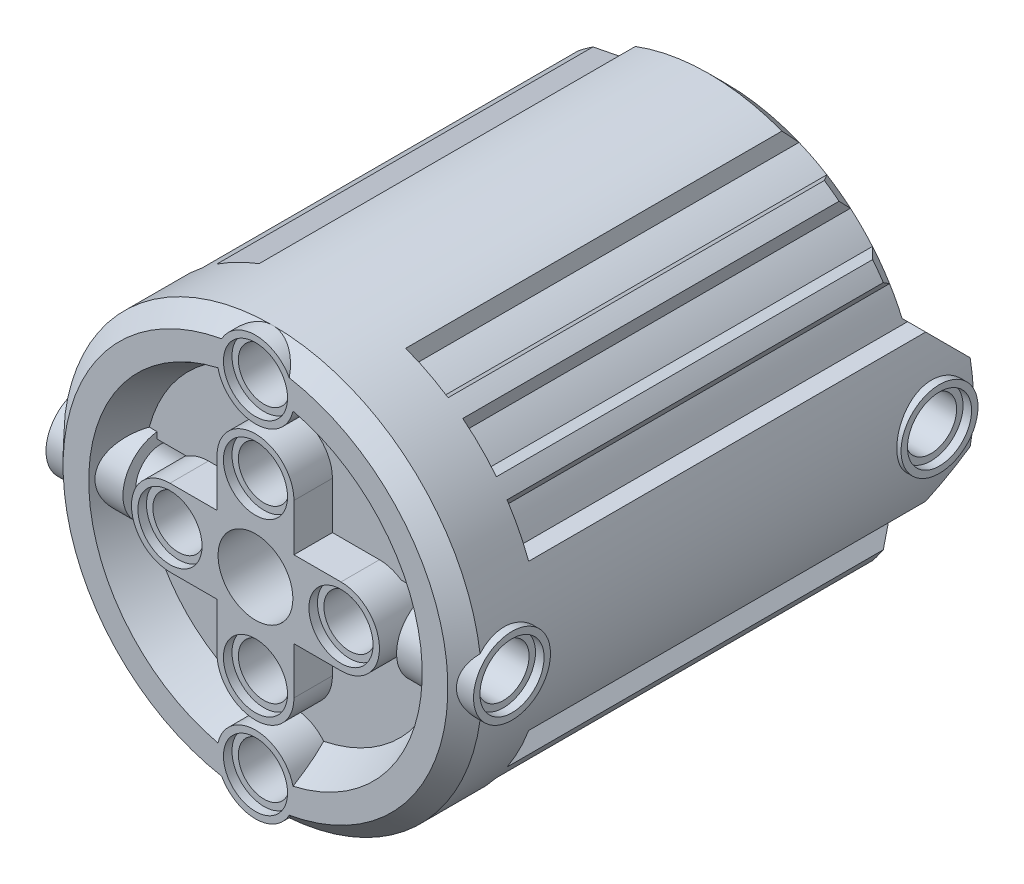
SolidWorks part; units mm, degrees
ref_plane "Front Plane" through (0, 0, 0) normal (0, 0, 1) x (1, 0, 0)
ref_plane "Top Plane" through (0, 0, 0) normal (0, 1, 0) x (1, 0, 0)
ref_plane "Right Plane" through (0, 0, 0) normal (1, 0, 0) x (0, 0, -1)
sketch "Sketch1" plane through (0, 0, 0) normal (0, 0, 1) x (1, 0, 0)
  circle A9 centre (0, 0) radius 19.6
extrude "Boss-Extrude1" add sketch "Sketch1" against normal blind 47.6
chamfer "Chamfer1" distance 1.6 angle 45 1 edges at (19.6, 0, 0)
sketch "Sketch2" plane through (0, 0, 0) normal (0, 0, 1) x (1, 0, 0)
  line L0 (-3.6, 8) -> (-3.6, 3.6)
  line L1 (3.6, 8) -> (3.6, 3.6)
  line L2 (8, 3.6) -> (3.6, 3.6)
  line L3 (-8, -3.6) -> (-3.6, -3.6)
  line L4 (-3.6, -3.6) -> (-3.6, -8)
  line L5 (-3.6, 3.6) -> (-8, 3.6)
  line L6 (3.6, -3.6) -> (3.6, -8)
  line L7 (3.6, -3.6) -> (8, -3.6)
  arc A0 (2.786, -13.72) -> (2.786, 13.72) centre (0, 0) ccw
  circle A1 centre (0, 0) radius 19.6 construction
  arc A2 (3.6, 8) -> (-3.6, 8) centre (0, 8) ccw
  arc A3 (-3.6, -8) -> (3.6, -8) centre (0, -8) ccw
  arc A4 (8, -3.6) -> (8, 3.6) centre (8, 0) ccw
  arc A5 (-8, 3.6) -> (-8, -3.6) centre (-8, 0) ccw
  arc A6 (-2.786, 13.72) -> (2.786, 13.72) centre (0, 16) ccw
  arc A7 (2.786, -13.72) -> (-2.786, -13.72) centre (0, -16) ccw
  arc A9 (-2.786, 13.72) -> (-2.786, -13.72) centre (0, 0) ccw
  dimension "D1" = 5.6
  dimension "D2" = 8
  dimension "D3" = 8
  dimension "D4" = 8
  dimension "D5" = 8
  dimension "D6" = 16
  dimension "D7" = 0
  dimension "D8" = 16
extrude "Cut-Extrude1" cut sketch "Sketch2" against normal blind 3.6
chamfer "Chamfer3" distance 1.6 distance2 3.6 1 edges at (-14, 0, 0)
chamfer "Chamfer4" distance 1.6 distance2 3.6 1 edges at (14, 0, 0)
sketch "Sketch4" plane through (0, 0, 0) normal (0, 0, 1) x (1, 0, 0)
  circle A0 centre (0, 16) radius 3.6
  circle A1 centre (0, -16) radius 3.6
extrude "Boss-Extrude2" add sketch "Sketch4" against normal blind 3.6
sketch "Sketch3" plane through (0, 0, 0) normal (0, 0, 1) x (1, 0, 0)
  circle A0 centre (0, 8) radius 2.4
  circle A1 centre (0, 0) radius 3.5
  circle A2 centre (8, 0) radius 2.4
  circle A3 centre (-8, 0) radius 2.4
  circle A4 centre (0, -8) radius 2.4
  circle A6 centre (0, 16) radius 2.4
  circle A7 centre (0, -16) radius 2.4
  dimension "D1" = 7
  dimension "D2" = 4.8
  dimension "D3" = 4.8
  dimension "D4" = 4.8
  dimension "D5" = 4.8
  dimension "D6" = 8
  dimension "D7" = 8
  dimension "D8" = 8
  dimension "D9" = 8
extrude "Cut-Extrude2" cut sketch "Sketch3" against normal blind 8
ref_plane "Plane1" through (20, 0, 0) normal (1, 0, 0) x (0, 0, -1)
sketch "Sketch5" plane through (20, 0, 0) normal (1, 0, 0) x (0, 0, -1)
  line L0 (0, 17.72) -> (0, -17.72) construction
  circle A1 centre (4, 0) radius 3.6
  circle A2 centre (44, 0) radius 3.6
  dimension "D1" = 4
  dimension "D2" = 40
extrude "Boss-Extrude3" add sketch "Sketch5" against normal blind 7.2
mirror "Mirror1" about plane through (0, 0, 0) normal (1, 0, 0) of "Boss-Extrude3"
sketch "Sketch6" plane through (0, 0, 0) normal (0, 0, 1) x (1, 0, 0)
  circle A0 centre (0, 8) radius 3
  circle A1 centre (8, 0) radius 3
  circle A2 centre (-8, 0) radius 3
  circle A3 centre (0, -8) radius 3
  circle A4 centre (0, -16) radius 3
  circle A5 centre (0, 16) radius 3
extrude "Cut-Extrude3" cut sketch "Sketch6" against normal blind 0.8
sketch "Sketch7" plane through (20, 0, 0) normal (1, 0, 0) x (0, 0, -1)
  circle A0 centre (4, 0) radius 2.4
  circle A1 centre (44, 0) radius 2.4
extrude "Cut-Extrude4" cut sketch "Sketch7" against normal up to surface (8.4 mm away)
sketch "Sketch8" plane through (20, 0, 0) normal (1, 0, 0) x (0, 0, -1)
  circle A0 centre (4, 0) radius 3
  circle A1 centre (44, 0) radius 3
extrude "Cut-Extrude5" cut sketch "Sketch8" against normal blind 0.8
sketch "Sketch9" plane through (20, 0, 0) normal (1, 0, 0) x (0, 0, -1)
  line L0 (44, 20.4632) -> (44, 7.2)
  line L1 (47.6, 0) -> (47.6, 19.6) construction
  line L2 (47.6, 20.4632) -> (47.6, 3.6)
  line L3 (47.6, 3.6) -> (44, 7.2)
  line L4 (44, 20.4632) -> (47.6, 20.4632)
  line L5 (4, 0) -> (44, 0) construction
  line L6 (44, -20.4632) -> (47.6, -20.4632)
  line L7 (47.6, -3.6) -> (44, -7.2)
  line L8 (47.6, -20.4632) -> (47.6, -3.6)
  line L9 (44, -20.4632) -> (44, -7.2)
  dimension "D1" = 3.6
  dimension "D2" = 3.6
extrude "Cut-Extrude6" cut sketch "Sketch9" against normal through all
ref_plane "Plane2" through (0, 0, -7.2) normal (0, 0, 1) x (1, 0, 0)
sketch "Sketch10" plane through (0, 0, -7.2) normal (0, 0, 1) x (1, 0, 0)
  line L3 (15.344, 12.1952) -> (13.7095, 11.6641)
  line L20 (6.8567, 18.3615) -> (6.8567, 16.6429)
  line L22 (10.8245, 16.3398) -> (9.4341, 15.3296)
  line L23 (12.1952, 15.344) -> (11.6641, 13.7095)
  line L24 (18.3615, 6.8567) -> (16.6429, 6.8567)
  line L26 (16.3398, 10.8245) -> (15.3296, 9.4341)
  line L31 (16.3398, -10.8245) -> (15.3296, -9.4341)
  line L32 (18.3615, -6.8567) -> (16.6429, -6.8567)
  line L33 (12.1952, -15.344) -> (11.6641, -13.7095)
  line L34 (15.344, -12.1952) -> (13.7095, -11.6641)
  line L35 (6.8567, -18.3615) -> (6.8567, -16.6429)
  line L36 (10.8245, -16.3398) -> (9.4341, -15.3296)
  line L41 (-10.8245, -16.3398) -> (-9.4341, -15.3296)
  line L42 (-6.8567, -18.3615) -> (-6.8567, -16.6429)
  line L43 (-15.344, -12.1952) -> (-13.7095, -11.6641)
  line L44 (-12.1952, -15.344) -> (-11.6641, -13.7095)
  line L45 (-18.3615, -6.8567) -> (-16.6429, -6.8567)
  line L46 (-16.3398, -10.8245) -> (-15.3296, -9.4341)
  line L51 (-16.3398, 10.8245) -> (-15.3296, 9.4341)
  line L52 (-18.3615, 6.8567) -> (-16.6429, 6.8567)
  line L53 (-12.1952, 15.344) -> (-11.6641, 13.7095)
  line L54 (-15.344, 12.1952) -> (-13.7095, 11.6641)
  line L55 (-6.8567, 18.3615) -> (-6.8567, 16.6429)
  line L56 (-10.8245, 16.3398) -> (-9.4341, 15.3296)
  line L61 (-0.8471, 19.5817) -> (-1.3782, 17.9472)
  line L62 (-5.2454, 18.8851) -> (-4.2352, 17.4947)
  line L63 (5.2454, 18.8851) -> (4.2352, 17.4947)
  line L64 (0.8471, 19.5817) -> (1.3782, 17.9472)
  line L65 (-19.5817, -0.8471) -> (-17.9472, -1.3782)
  line L66 (-19.5817, 0.8471) -> (-17.9472, 1.3782)
  line L67 (-18.8851, 5.2454) -> (-17.4947, 4.2352)
  line L68 (-18.8851, -5.2454) -> (-17.4947, -4.2352)
  line L69 (0.8471, -19.5817) -> (1.3782, -17.9472)
  line L70 (5.2454, -18.8851) -> (4.2352, -17.4947)
  line L71 (-5.2454, -18.8851) -> (-4.2352, -17.4947)
  line L72 (-0.8471, -19.5817) -> (-1.3782, -17.9472)
  line L73 (19.5817, 0.8471) -> (17.9472, 1.3782)
  line L74 (18.8851, 5.2454) -> (17.4947, 4.2352)
  line L75 (18.8851, -5.2454) -> (17.4947, -4.2352)
  line L76 (19.5817, -0.8471) -> (17.9472, -1.3782)
  arc A4 (6.8567, 16.6429) -> (9.4552, 15.3166) centre (0, 0) cw
  arc A5 (6.8567, 18.3615) -> (10.8334, 16.334) centre (0, 0) cw
  arc A6 (12.1952, 15.344) -> (15.3506, 12.1868) centre (0, 0) cw
  arc A7 (11.6641, 13.7095) -> (13.7255, 11.6452) centre (0, 0) cw
  arc A8 (16.3398, 10.8245) -> (18.3652, 6.8467) centre (0, 0) cw
  arc A9 (15.3296, 9.4341) -> (16.6523, 6.8338) centre (0, 0) cw
  arc A14 (18.3615, -6.8567) -> (16.334, -10.8334) centre (0, 0) cw
  arc A15 (16.6429, -6.8567) -> (15.3166, -9.4552) centre (0, 0) cw
  arc A16 (15.344, -12.1952) -> (12.1868, -15.3506) centre (0, 0) cw
  arc A17 (13.7095, -11.6641) -> (11.6452, -13.7255) centre (0, 0) cw
  arc A18 (10.8245, -16.3398) -> (6.8467, -18.3652) centre (0, 0) cw
  arc A19 (9.4341, -15.3296) -> (6.8338, -16.6523) centre (0, 0) cw
  arc A24 (-6.8567, -18.3615) -> (-10.8334, -16.334) centre (0, 0) cw
  arc A25 (-6.8567, -16.6429) -> (-9.4552, -15.3166) centre (0, 0) cw
  arc A26 (-12.1952, -15.344) -> (-15.3506, -12.1868) centre (0, 0) cw
  arc A27 (-11.6641, -13.7095) -> (-13.7255, -11.6452) centre (0, 0) cw
  arc A28 (-16.3398, -10.8245) -> (-18.3652, -6.8467) centre (0, 0) cw
  arc A29 (-15.3296, -9.4341) -> (-16.6523, -6.8338) centre (0, 0) cw
  arc A34 (-18.3615, 6.8567) -> (-16.334, 10.8334) centre (0, 0) cw
  arc A35 (-16.6429, 6.8567) -> (-15.3166, 9.4552) centre (0, 0) cw
  arc A36 (-15.344, 12.1952) -> (-12.1868, 15.3506) centre (0, 0) cw
  arc A37 (-13.7095, 11.6641) -> (-11.6452, 13.7255) centre (0, 0) cw
  arc A38 (-10.8245, 16.3398) -> (-6.8467, 18.3652) centre (0, 0) cw
  arc A39 (-9.4341, 15.3296) -> (-6.8338, 16.6523) centre (0, 0) cw
  arc A44 (-5.2454, 18.8851) -> (-0.8365, 19.5821) centre (0, 0) cw
  arc A45 (-4.2352, 17.4947) -> (-1.3535, 17.949) centre (0, 0) cw
  arc A46 (0.8471, 19.5817) -> (5.2557, 18.8822) centre (0, 0) cw
  arc A47 (1.3782, 17.9472) -> (4.2593, 17.4888) centre (0, 0) cw
  arc A48 (-17.4947, -4.2352) -> (-17.949, -1.3535) centre (0, 0) cw
  arc A49 (-17.9472, 1.3782) -> (-17.4888, 4.2593) centre (0, 0) cw
  arc A50 (-19.5817, 0.8471) -> (-18.8822, 5.2557) centre (0, 0) cw
  arc A51 (-18.8851, -5.2454) -> (-19.5821, -0.8365) centre (0, 0) cw
  arc A52 (5.2454, -18.8851) -> (0.8365, -19.5821) centre (0, 0) cw
  arc A53 (4.2352, -17.4947) -> (1.3535, -17.949) centre (0, 0) cw
  arc A54 (-0.8471, -19.5817) -> (-5.2557, -18.8822) centre (0, 0) cw
  arc A55 (-1.3782, -17.9472) -> (-4.2593, -17.4888) centre (0, 0) cw
  arc A56 (18.8851, 5.2454) -> (19.5821, 0.8365) centre (0, 0) cw
  arc A57 (17.4947, 4.2352) -> (17.949, 1.3535) centre (0, 0) cw
  arc A58 (19.5817, -0.8471) -> (18.8822, -5.2557) centre (0, 0) cw
  arc A59 (17.9472, -1.3782) -> (17.4888, -4.2593) centre (0, 0) cw
chamfer "Chamfer5" distance 1.6 angle 45 1 edges at (0, 19.6, -44)
chamfer "Chamfer6" distance 1.6 angle 45 1 edges at (0, -19.6, -44)
sketch "Sketch12" plane through (0, 0, -7.2) normal (0, 0, 1) x (1, 0, 0)
  line L0 (6.8567, 16.6429) -> (6.8567, 21.2509)
  line L1 (9.4552, 15.3166) -> (10.8245, 16.3398)
  line L2 (11.6641, 13.7095) -> (13.088, 18.092)
  line L3 (13.7255, 11.6452) -> (15.344, 12.1952)
  line L4 (15.3296, 9.4341) -> (18.0382, 13.1621)
  line L5 (16.6523, 6.8338) -> (18.3615, 6.8567)
  line L10 (16.6429, -6.8567) -> (21.2509, -6.8567)
  line L11 (15.3166, -9.4552) -> (16.3398, -10.8245)
  line L12 (13.7095, -11.6641) -> (18.092, -13.088)
  line L13 (11.6452, -13.7255) -> (12.1952, -15.344)
  line L14 (9.4341, -15.3296) -> (13.1621, -18.0382)
  line L15 (6.8338, -16.6523) -> (6.8567, -18.3615)
  line L20 (-6.8567, -16.6429) -> (-6.8567, -21.2509)
  line L21 (-9.4552, -15.3166) -> (-10.8245, -16.3398)
  line L22 (-11.6641, -13.7095) -> (-13.088, -18.092)
  line L23 (-13.7255, -11.6452) -> (-15.344, -12.1952)
  line L24 (-15.3296, -9.4341) -> (-18.0382, -13.1621)
  line L25 (-16.6523, -6.8338) -> (-18.3615, -6.8567)
  line L30 (-16.6429, 6.8567) -> (-21.2509, 6.8567)
  line L31 (-15.3166, 9.4552) -> (-16.3398, 10.8245)
  line L32 (-13.7095, 11.6641) -> (-18.092, 13.088)
  line L33 (-11.6452, 13.7255) -> (-12.1952, 15.344)
  line L34 (-9.4341, 15.3296) -> (-13.1621, 18.0382)
  line L35 (-6.8338, 16.6523) -> (-6.8567, 18.3615)
  line L40 (-4.2352, 17.4947) -> (-6.9438, 21.2227)
  line L41 (-1.3535, 17.949) -> (-0.8471, 19.5817)
  line L42 (1.3782, 17.9472) -> (-0.0458, 22.3297)
  line L43 (4.2593, 17.4888) -> (5.2454, 18.8851)
  line L44 (17.949, 1.3535) -> (19.5817, 0.8471)
  line L45 (17.9472, -1.3782) -> (22.3297, 0.0458)
  line L46 (17.4888, -4.2593) -> (18.8851, -5.2454)
  line L47 (17.4947, 4.2352) -> (21.2227, 6.9438)
  line L48 (1.3535, -17.949) -> (0.8471, -19.5817)
  line L49 (-1.3782, -17.9472) -> (0.0458, -22.3297)
  line L50 (4.2352, -17.4947) -> (6.9438, -21.2227)
  line L51 (-4.2593, -17.4888) -> (-5.2454, -18.8851)
  line L52 (-17.4947, -4.2352) -> (-21.2227, -6.9438)
  line L53 (-17.949, -1.3535) -> (-19.5817, -0.8471)
  line L54 (-17.9472, 1.3782) -> (-22.3297, -0.0458)
  line L55 (-17.4888, 4.2593) -> (-18.8851, 5.2454)
  arc A0 (6.8567, 16.6429) -> (9.4552, 15.3166) centre (0, 0) cw
  arc A1 (9.4552, 15.3166) -> (6.8567, 16.6429) centre (0, 0) ccw construction
  arc A2 (10.8245, 16.3398) -> (6.8567, 21.2509) centre (-56.0505, -33.6313) ccw
  arc A3 (11.6641, 13.7095) -> (13.7255, 11.6452) centre (0, 0) cw
  arc A4 (15.344, 12.1952) -> (13.088, 18.092) centre (-63.6998, -14.6647) ccw
  arc A5 (15.3296, 9.4341) -> (16.6523, 6.8338) centre (0, 0) cw
  arc A6 (18.3615, 6.8567) -> (18.0382, 13.1621) centre (-65.1138, 5.7374) ccw
  arc A11 (16.6429, -6.8567) -> (15.3166, -9.4552) centre (0, 0) cw
  arc A12 (16.3398, -10.8245) -> (21.2509, -6.8567) centre (-33.6313, 56.0505) ccw
  arc A13 (13.7095, -11.6641) -> (11.6452, -13.7255) centre (0, 0) cw
  arc A14 (12.1952, -15.344) -> (18.092, -13.088) centre (-14.6647, 63.6998) ccw
  arc A15 (9.4341, -15.3296) -> (6.8338, -16.6523) centre (0, 0) cw
  arc A16 (6.8567, -18.3615) -> (13.1621, -18.0382) centre (5.7374, 65.1138) ccw
  arc A21 (-6.8567, -16.6429) -> (-9.4552, -15.3166) centre (0, 0) cw
  arc A22 (-10.8245, -16.3398) -> (-6.8567, -21.2509) centre (56.0505, 33.6313) ccw
  arc A23 (-11.6641, -13.7095) -> (-13.7255, -11.6452) centre (0, 0) cw
  arc A24 (-15.344, -12.1952) -> (-13.088, -18.092) centre (63.6998, 14.6647) ccw
  arc A25 (-15.3296, -9.4341) -> (-16.6523, -6.8338) centre (0, 0) cw
  arc A26 (-18.3615, -6.8567) -> (-18.0382, -13.1621) centre (65.1138, -5.7374) ccw
  arc A31 (-16.6429, 6.8567) -> (-15.3166, 9.4552) centre (0, 0) cw
  arc A32 (-16.3398, 10.8245) -> (-21.2509, 6.8567) centre (33.6313, -56.0505) ccw
  arc A33 (-13.7095, 11.6641) -> (-11.6452, 13.7255) centre (0, 0) cw
  arc A34 (-12.1952, 15.344) -> (-18.092, 13.088) centre (14.6647, -63.6998) ccw
  arc A35 (-9.4341, 15.3296) -> (-6.8338, 16.6523) centre (0, 0) cw
  arc A36 (-6.8567, 18.3615) -> (-13.1621, 18.0382) centre (-5.7374, -65.1138) ccw
  arc A41 (-4.2352, 17.4947) -> (-1.3535, 17.949) centre (0, 0) cw
  arc A42 (-0.8471, 19.5817) -> (-6.9438, 21.2227) centre (-25.5779, -60.1539) ccw
  arc A43 (1.3782, 17.9472) -> (4.2593, 17.4888) centre (0, 0) cw
  arc A44 (5.2454, 18.8851) -> (-0.0458, 22.3297) centre (-42.9146, -49.3058) ccw
  arc A45 (17.4947, 4.2352) -> (17.949, 1.3535) centre (0, 0) cw
  arc A46 (19.5817, 0.8471) -> (21.2227, 6.9438) centre (-60.1539, 25.5779) ccw
  arc A47 (17.9472, -1.3782) -> (17.4888, -4.2593) centre (0, 0) cw
  arc A48 (18.8851, -5.2454) -> (22.3297, 0.0458) centre (-49.3058, 42.9146) ccw
  arc A49 (4.2352, -17.4947) -> (1.3535, -17.949) centre (0, 0) cw
  arc A50 (0.8471, -19.5817) -> (6.9438, -21.2227) centre (25.5779, 60.1539) ccw
  arc A51 (-1.3782, -17.9472) -> (-4.2593, -17.4888) centre (0, 0) cw
  arc A52 (-5.2454, -18.8851) -> (0.0458, -22.3297) centre (42.9146, 49.3058) ccw
  arc A53 (-17.4947, -4.2352) -> (-17.949, -1.3535) centre (0, 0) cw
  arc A54 (-19.5817, -0.8471) -> (-21.2227, -6.9438) centre (60.1539, -25.5779) ccw
  arc A55 (-17.9472, 1.3782) -> (-17.4888, 4.2593) centre (0, 0) cw
  arc A56 (-18.8851, 5.2454) -> (-22.3297, -0.0458) centre (49.3058, -42.9146) ccw
  point P110 (0, 0)
  dimension "D1" = 20
extrude "Cut-Extrude7" cut sketch "Sketch12" against normal through all
sketch "Sketch13" plane through (-20, 0, 0) normal (-1, 0, 0) x (0, 0, 1)
  circle A0 centre (-4, 0) radius 3
  circle A1 centre (-44, 0) radius 3
extrude "Cut-Extrude8" cut sketch "Sketch13" against normal blind 0.8
sketch "Sketch14" plane through (-20, 0, 0) normal (-1, 0, 0) x (0, 0, 1)
  circle A0 centre (-4, 0) radius 2.4
  circle A1 centre (-44, 0) radius 2.4
extrude "Cut-Extrude9" cut sketch "Sketch14" against normal up to surface (8.4 mm away)
sketch "Sketch15" plane through (12.8, 0, 0) normal (-1, 0, 0) x (0, 0, 1)
  circle A0 centre (-4, 0) radius 3
extrude "Cut-Extrude10" cut sketch "Sketch15" along normal up to surface (1.2 mm away)
sketch "Sketch16" plane through (-12.8, 0, 0) normal (1, 0, 0) x (0, 0, -1)
  circle A0 centre (4, 0) radius 3
extrude "Cut-Extrude11" cut sketch "Sketch16" along normal up to surface (1.2 mm away)
